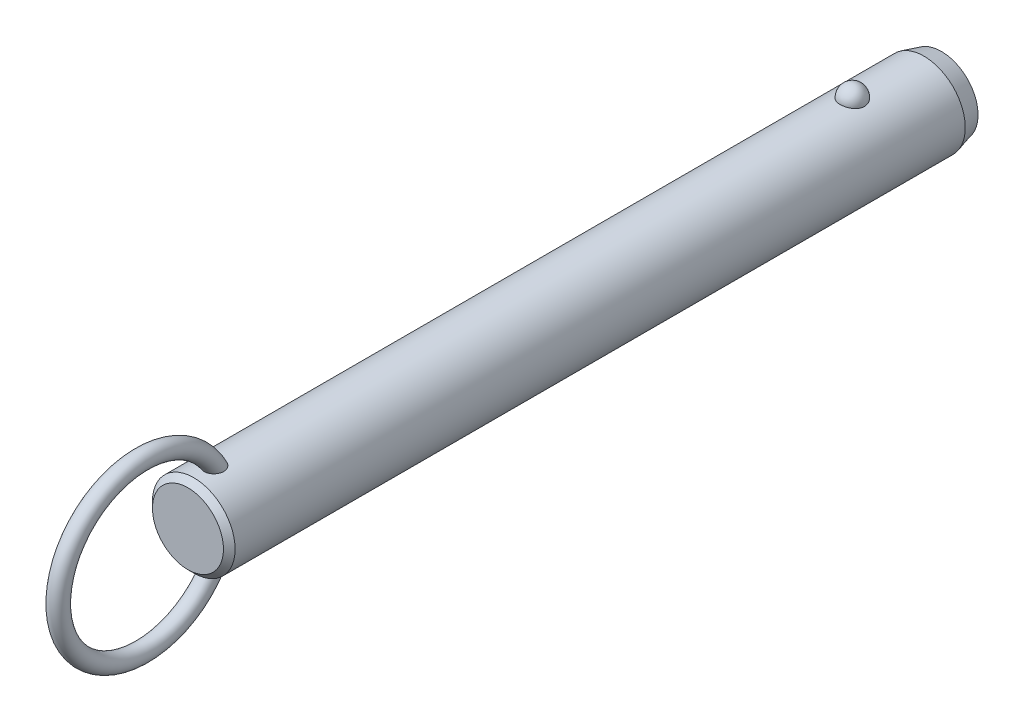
SolidWorks part; units mm, degrees
ref_plane "Front Plane" through (0, 0, 0) normal (0, 0, 1) x (1, 0, 0)
ref_plane "Top Plane" through (0, 0, 0) normal (0, 1, 0) x (1, 0, 0)
ref_plane "Right Plane" through (0, 0, 0) normal (1, 0, 0) x (0, 0, -1)
sketch "Sketch2" plane through (0, 0, 0) normal (0, 0, 1) x (1, 0, 0)
  circle A0 centre (0, 0) radius 7.1
  point P3 (0, 7.1)
  dimension "D1" = 14.2
extrude "Boss-Extrude1" add sketch "Sketch2" along normal blind 104.1
sketch "Sketch3" plane through (0, 0, 0) normal (0, 0, -1) x (-1, 0, 0)
  circle A0 centre (0, 0) radius 7.1
  dimension "D1" = 14.2
extrude "Boss-Extrude2" add sketch "Sketch3" along normal blind 17.4
chamfer "Chamfer1" distance 3 angle 15 1 edges at (-7.1, 0, -17.4)
sketch "Sketch12" plane through (0, 0, 0) normal (1, 0, 0) x (0, 0, -1)
  line L0 (-104.1, 7.1) -> (-104.1, -7.1) construction
  point P0 (-104.1, 0)
sketch "Sketch13" plane through (0, 0, 0) normal (1, 0, 0) x (0, 0, -1)
  circle A0 centre (-119.95, 0) radius 15.85
  point P2 (-104.1, 0)
  dimension "D1" = 31.7
sketch "Sketch14" plane through (0, 0, 0) normal (0, 1, 0) x (1, 0, 0)
  circle A0 centre (0, -105.6) radius 1.5
  point P2 (0, -104.1)
  dimension "D1" = 3
sweep "Sweep1" add profiles "Sketch14" path "Sketch13"
sketch "Sketch15" plane through (0, 0, 104.1) normal (0, 0, 1) x (1, 0, 0)
  circle A0 centre (0, 0) radius 7.1
  dimension "D1" = 14.2
extrude "Boss-Extrude3" add sketch "Sketch15" along normal blind 7.92
chamfer "Chamfer2" distance 1 angle 45 1 edges at (7.1, 0, 112.02)
sketch "Sketch18" plane through (0, 0, 0) normal (1, 0, 0) x (0, 0, -1)
  line L0 (14.4, 7.1) -> (-105.7792, 7.1) construction
  line L1 (2.1, 9.2) -> (2.1, 5)
  line L2 (-105.7792, -7.1) -> (14.4, -7.1) construction
  arc A0 (2.1, 9.2) -> (2.1, 5) centre (2.1, 7.1) ccw
  point P4 (0, 7.1)
  dimension "D1" = 16.3
revolve "Revolve1" add sketch "Sketch18" angle 360 about L1
